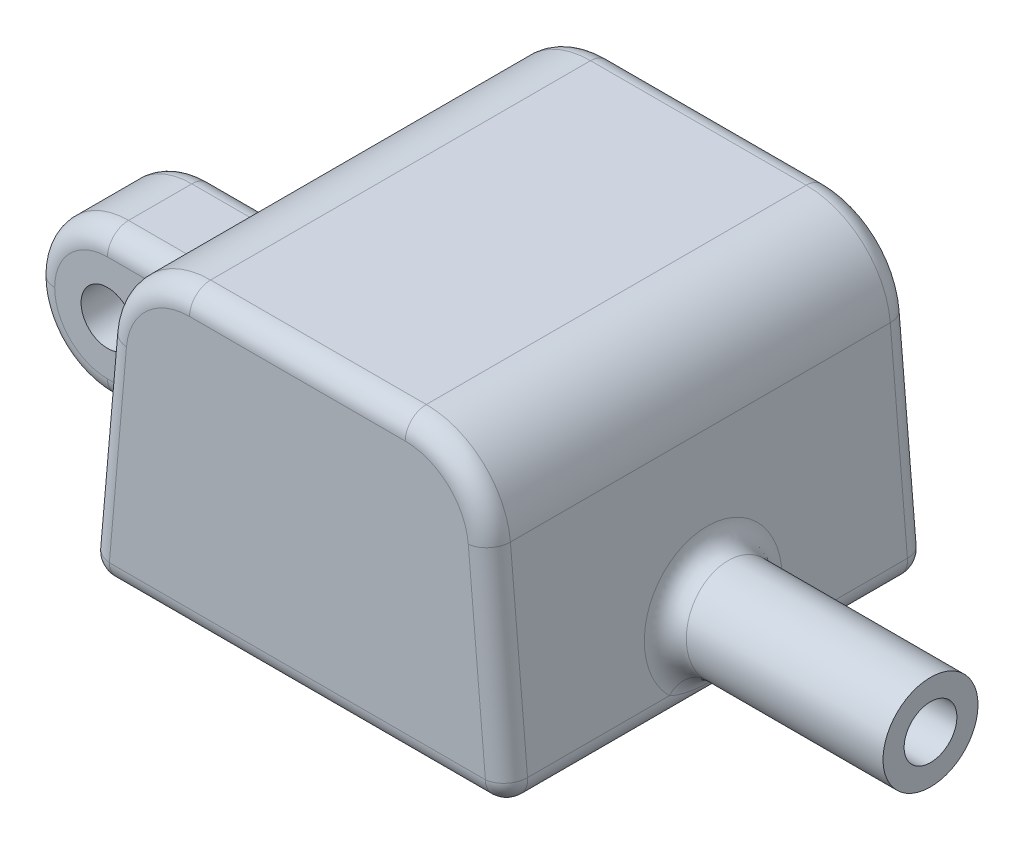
SolidWorks part; units mm, degrees
ref_plane "Front Plane" through (0, 0, 0) normal (0, 0, 1) x (1, 0, 0)
ref_plane "Top Plane" through (0, 0, 0) normal (0, 1, 0) x (1, 0, 0)
ref_plane "Right Plane" through (0, 0, 0) normal (1, 0, 0) x (0, 0, -1)
sketch "Sketch1" plane through (0, 0, 0) normal (0, 1, 0) x (1, 0, 0)
  line L1 (-50, 50) -> (50, 50)
  line L2 (-50, 50) -> (-50, -50)
  line L3 (-50, -50) -> (50, -50)
  line L4 (50, 50) -> (50, -50)
  line L5 (-50, 50) -> (50, -50) construction
  line L6 (-50, -50) -> (50, 50) construction
  point P0 (0, 0)
  dimension "D1" = 100
  dimension "D2" = 100
extrude "Boss-Extrude1" add sketch "Sketch1" along normal blind 70
sketch "Sketch2" plane through (0, 0, 0) normal (0, 1, 0) x (1, 0, 0)
  line L0 (0, 0) -> (-50, 0) construction
  line L1 (-50, 50) -> (-50, -50) construction
  line L3 (-50, -12.5) -> (-100, -12.5)
  line L4 (-50, -12.5) -> (-50, 12.5)
  line L5 (-50, 12.5) -> (-100, 12.5)
  line L6 (-100, -12.5) -> (-100, 12.5)
  dimension "D1" = 25
  dimension "D2" = 50
extrude "Boss-Extrude2" add sketch "Sketch2" along normal blind 35
fillet "Fillet1" radius 17.5 2 edges at (-100, 0, 0) (-100, 35, 0)
sketch "Sketch3" plane through (50, 0, 0) normal (1, 0, 0) x (0, 0, -1)
  line L0 (20.4542, 17.5) -> (-12.5, 17.5) construction
  circle A0 centre (0, 17.5) radius 11.25
  circle A1 centre (0, 17.5) radius 6.25
  dimension "D1" = 5
  dimension "D2" = 12.5
extrude "Boss-Extrude3" add sketch "Sketch3" along normal blind 50
draft "Draft1" type of draft neutral plane draft angle 5 faces to draft 2 parameters "D1"=5
hole_wizard "Ø12.5 (12.5) Diameter Hole1" positions "Sketch5" profile "Sketch4" hole size "Ø12.5" standard "Ansi Metric"
sketch "Sketch5" plane through (0, 0, 12.5) normal (0, 0, 1) x (1, 0, 0)
  point P0 (-82.5, 17.5)
sketch "Sketch4" plane through (-82.5, 17.5, 12.5) normal (1, 0, 0) x (0, -1, 0)
  line L0 (0, 0) -> (0, 38.7554)
  line L1 (0, 38.7554) -> (6.25, 35)
  line L2 (6.25, 35) -> (6.25, 0)
  line L5 (6.25, 0) -> (0, 0)
  line L10 (0, 38.7554) -> (-6.25, 35) construction
  line L11 (0, -6.35) -> (0, 107.95) construction
  dimension "Hole Dia." = 12.5
  dimension "Hole Depth" = 35
  dimension "Drill Angle" = 118
fillet "Fillet2" radius 20 2 edges at (43.8758, 70, 0) (-43.8758, 70, 0)
fillet "Fillet3" radius 5 23 edges at (-66.25, 0, -12.5) (-94.8744, 5.1256, -12.5) (-94.8744, 29.8744, -12.5) (-66.25, 0, 12.5) (-94.8744, 5.1256, 12.5) (-94.8744, 29.8744, 12.5) (47.7365, 25.8716, -50) (39.061, 64.7455, -50) (-47.7365, 25.8716, -50) (-39.061, 64.7455, -50) (-47.7365, 25.8716, 50) (-39.061, 64.7455, 50) (47.7365, 25.8716, 50) (39.061, 64.7455, 50) (-64.7189, 35, -12.5) (-64.7189, 35, 12.5) (0, 70, -50) (0, 70, 50) (-50, 0, 31.25) (0, 0, 50) (50, 0, 0) (0, 0, -50) (-50, 0, -31.25)
fillet "Fillet4" radius 5 1 edges at (47.4847, 28.75, 0)
fillet "Fillet5" radius 5 9 edges at (-48.4499, 17.7179, -12.5) (-48.4499, 17.7179, 12.5) (-48.079, 1.4645, -11.0355) (-49.5387, 5.2181, -12.5) (-47.066, 33.5355, -11.0355) (-46.9379, 35, 0) (-47.066, 33.5355, 11.0355) (-48.079, 1.4645, 11.0355) (-49.5387, 5.2181, 12.5)
equation "\"D1@Fillet1\" = \"D1@Boss-Extrude2\"/2"
